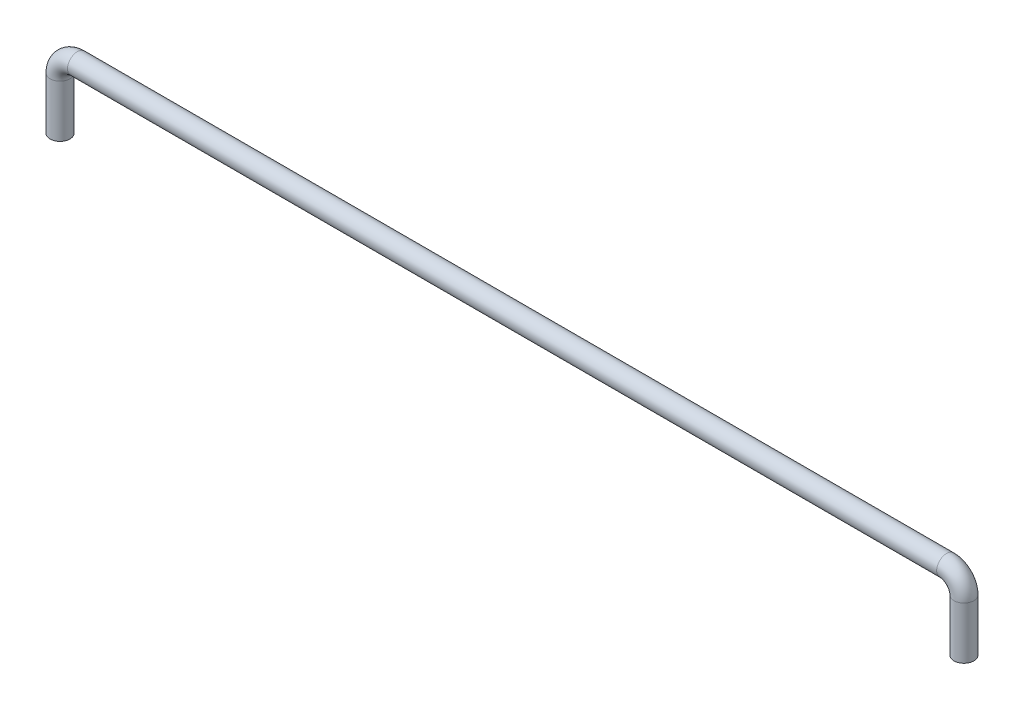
SolidWorks part; units mm, degrees
ref_plane "Front Plane" through (0, 0, 0) normal (0, 0, 1) x (1, 0, 0)
ref_plane "Top Plane" through (0, 0, 0) normal (0, 1, 0) x (1, 0, 0)
ref_plane "Right Plane" through (0, 0, 0) normal (1, 0, 0) x (0, 0, -1)
sketch "Sketch1" plane through (0, 0, 0) normal (0, 0, 1) x (1, 0, 0)
  line L2 (0, 0) -> (0, 7.62)
  line L3 (2.54, 10.16) -> (129.54, 10.16)
  line L4 (132.08, 0) -> (132.08, 7.62)
  arc A0 (129.54, 10.16) -> (132.08, 7.62) centre (129.54, 7.62) cw
  arc A1 (0, 7.62) -> (2.54, 10.16) centre (2.54, 7.62) cw
  point P5 (0, 0)
  dimension "D1" = 2.54
  dimension "D2" = 7.62
  dimension "D3" = 127
  dimension "D4" = 7.62
sketch "Sketch2" plane through (0, 0, 0) normal (0, 1, 0) x (1, 0, 0)
  circle A0 centre (0, 0) radius 1.45
  dimension "D1" = 2.9
sweep "Sweep1" add profiles "Sketch2" path "Sketch1"
